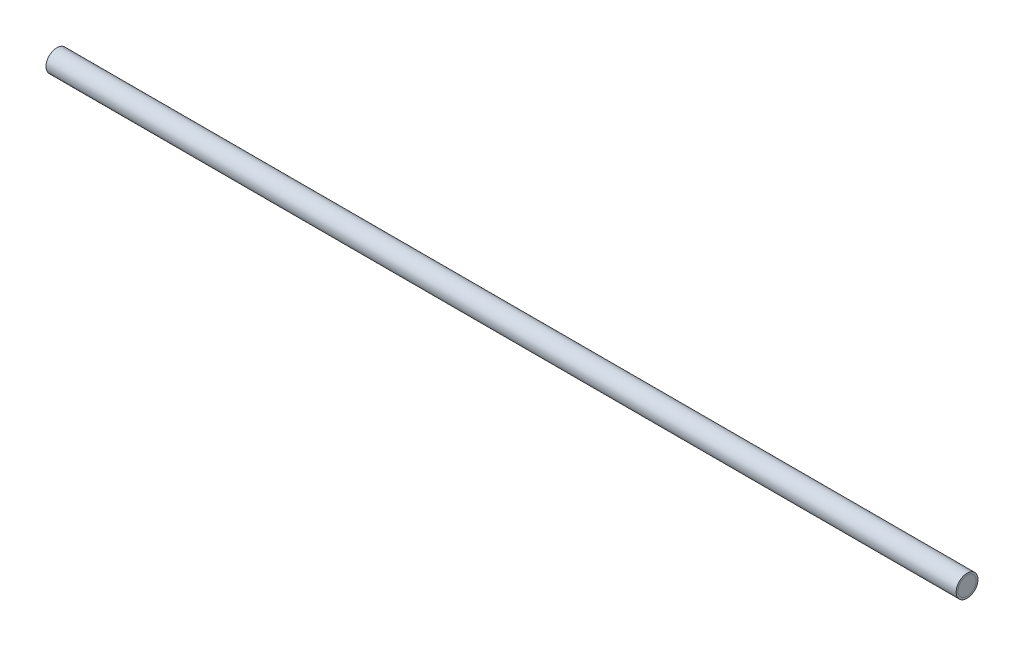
SolidWorks part; units mm, degrees
ref_plane "Front Plane" through (0, 0, 0) normal (0, 0, 1) x (1, 0, 0)
ref_plane "Top Plane" through (0, 0, 0) normal (0, 1, 0) x (1, 0, 0)
ref_plane "Right Plane" through (0, 0, 0) normal (1, 0, 0) x (0, 0, -1)
sketch "Sketch1" plane through (0, 0, 0) normal (1, 0, 0) x (0, 0, -1)
  circle A0 centre (0, 0) radius 100
  circle A1 centre (0, 0) radius 120
extrude "Extrude1" add sketch "Sketch1" along normal blind 10000
sketch "x = 45D"
sketch "x = 0 - 10 m (centerline)"
  line L0 (0, 0) -> (10000, 0)
sketch "x = 0 - 10 m (wall)" plane through (0, 0, 0) normal (0, 0, 1) x (1, 0, 0)
  line L0 (0, 100) -> (10000, 100)
  line L1 (10000, 100) -> (0, 100) construction
imported_body "LID1"
imported_body "LID2"
